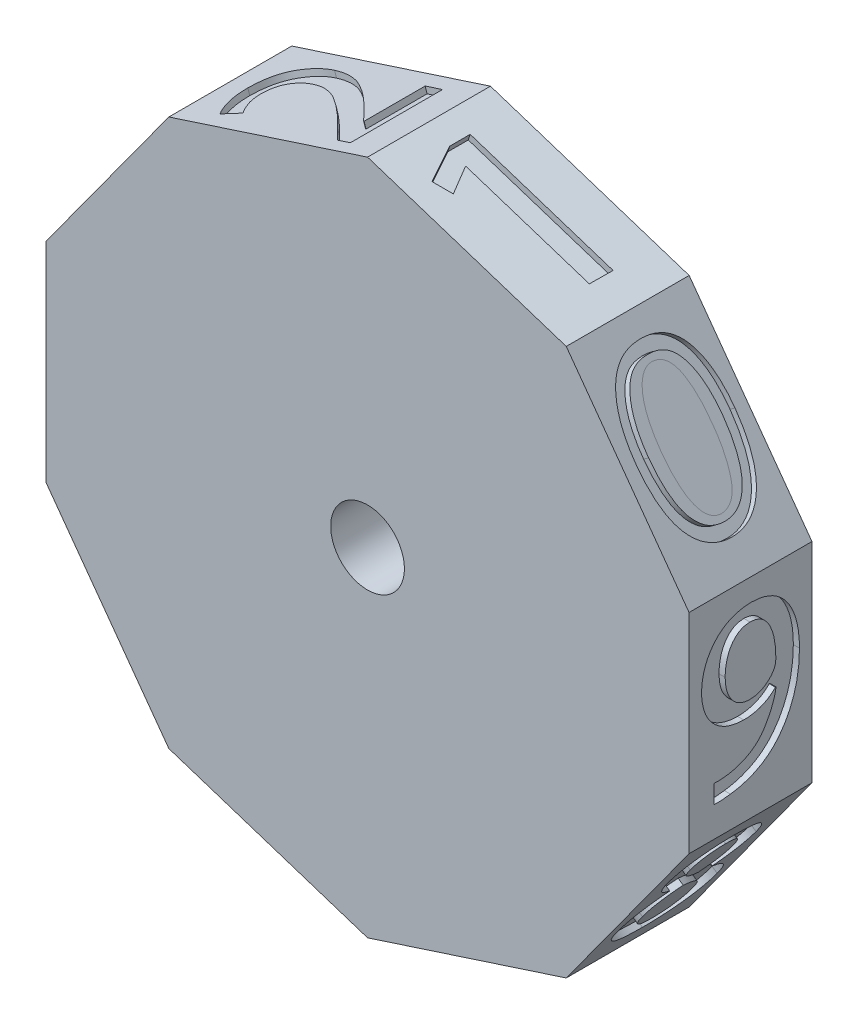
SolidWorks part; units mm, degrees
ref_plane "前基準面" through (0, 0, 0) normal (0, 0, 1) x (1, 0, 0)
ref_plane "上基準面" through (0, 0, 0) normal (0, 1, 0) x (1, 0, 0)
ref_plane "右基準面" through (0, 0, 0) normal (1, 0, 0) x (0, 0, -1)
sketch "草圖1" plane through (0, 0, 0) normal (0, 0, 1) x (1, 0, 0)
  line L0 (-32.3359, 44.5066) -> (-52.3206, 17)
  line L1 (0, -55.0132) -> (32.3359, -44.5066)
  line L2 (32.3359, -44.5066) -> (52.3206, -17)
  line L3 (52.3206, -17) -> (52.3206, 17)
  line L4 (52.3206, 17) -> (32.3359, 44.5066)
  line L5 (32.3359, 44.5066) -> (0, 55.0132)
  line L6 (0, 55.0132) -> (-32.3359, 44.5066)
  line L7 (-52.3206, 17) -> (-52.3206, -17)
  line L8 (-52.3206, -17) -> (-32.3359, -44.5066)
  line L9 (-32.3359, -44.5066) -> (0, -55.0132)
  circle A0 centre (0, 0) radius 52.3206 construction
  circle A1 centre (0, 0) radius 6
  dimension "D2" = 12
  dimension "D1" = 34
extrude "填料-伸長1" add sketch "草圖1" along normal mid plane 20
sketch "草圖2" plane through (42.3283, 30.7533, 0) normal (0.809, 0.5878, 0) x (0, 0, -1)
  text T0 "0  " font "@Adobe 黑体 Std R" height 25
wrap "包覆1" sketch "草圖2" wrap type scribe source sketch "草圖2"
sketch "草圖4" plane through (16.168, 49.7599, 0) normal (0.309, 0.9511, 0) x (0.9511, -0.309, 0)
  line L0 (11.5497, 10) -> (11.5497, -10) construction
  line L1 (17, 10) -> (-17, 10) construction
  line L2 (17, -10) -> (-17, -10) construction
  text T0 "1" font "@Adobe 黑体 Std R" height 25
wrap "包覆2" sketch "草圖4" wrap type deboss source sketch "草圖4" thickness 1 parameters "D1"=1
sketch "草圖6" plane through (-16.168, 49.7599, 0) normal (-0.309, 0.9511, 0) x (0.9511, 0.309, 0)
  line L0 (11.6881, 10) -> (11.6881, -10) construction
  line L1 (17, 10) -> (-17, 10) construction
  line L2 (17, -10) -> (-17, -10) construction
  text T0 "2  " font "@Adobe 黑体 Std R" height 25
wrap "包覆3" sketch "草圖6" wrap type deboss source sketch "草圖6" thickness 1 parameters "D1"=1
sketch "草圖8" plane through (-42.3283, 30.7533, 0) normal (-0.809, 0.5878, 0) x (0, 0, 1)
  line L0 (-10, 10.6951) -> (10, 10.6951) construction
  line L1 (-10, 17) -> (-10, -17) construction
  line L2 (10, 17) -> (10, -17) construction
  text T0 "3  " font "@Adobe 黑体 Std R" height 25
wrap "包覆4" sketch "草圖8" wrap type deboss source sketch "草圖8" thickness 1 parameters "D1"=1
sketch "草圖9" plane through (-52.3206, 0, 0) normal (-1, 0, 0) x (0, 0, 1)
  line L0 (10, 11.2281) -> (-10, 11.2281) construction
  line L1 (10, 17) -> (10, -17) construction
  line L2 (-10, 17) -> (-10, -17) construction
  text T0 "4  " font "@Adobe 黑体 Std R" height 25
wrap "包覆5" sketch "草圖9" wrap type deboss source sketch "草圖9" thickness 1 parameters "D1"=1
sketch "草圖10" plane through (-42.3283, -30.7533, 0) normal (-0.809, -0.5878, 0) x (0, 0, 1)
  line L0 (10, 10.2731) -> (-10, 10.2731) construction
  line L1 (10, 17) -> (10, -17) construction
  line L2 (-10, 17) -> (-10, -17) construction
  text T0 "5  " font "@Adobe 黑体 Std R" height 25
wrap "包覆6" sketch "草圖10" wrap type deboss source sketch "草圖10" thickness 1 parameters "D1"=1
sketch "草圖11" plane through (-16.168, -49.7599, 0) normal (-0.309, -0.9511, 0) x (0.9511, -0.309, 0)
  line L0 (-12.4961, 10) -> (-12.4961, -10) construction
  line L1 (-17, 10) -> (17, 10) construction
  line L2 (-17, -10) -> (17, -10) construction
  text T0 "6" font "@Adobe 黑体 Std R" height 25
wrap "包覆7" sketch "草圖11" wrap type deboss source sketch "草圖11" thickness 1 parameters "D1"=1
sketch "草圖12" plane through (16.168, -49.7599, 0) normal (0.309, -0.9511, 0) x (0.9511, 0.309, 0)
  line L0 (-12.6771, 10) -> (-12.6771, -10) construction
  line L1 (-17, 10) -> (17, 10) construction
  line L2 (-17, -10) -> (17, -10) construction
  text T0 "7" font "@Adobe 黑体 Std R" height 25
wrap "包覆8" sketch "草圖12" wrap type scribe source sketch "草圖12"
sketch "草圖13" plane through (42.3283, -30.7533, 0) normal (0.809, -0.5878, 0) x (0, 0, -1)
  line L0 (-10, -12.4282) -> (10, -12.4282) construction
  line L1 (-10, -17) -> (-10, 17) construction
  line L2 (10, -17) -> (10, 17) construction
  text T0 "8" font "@Adobe 黑体 Std R" height 25
wrap "包覆9" sketch "草圖13" wrap type deboss source sketch "草圖13" thickness 1 parameters "D1"=1
sketch "草圖14" plane through (52.3206, 0, 0) normal (1, 0, 0) x (0, 0, -1)
  line L0 (-10, -11.6825) -> (10, -11.6825) construction
  line L1 (-10, -17) -> (-10, 17) construction
  line L2 (10, -17) -> (10, 17) construction
  text T0 "9" font "@Adobe 黑体 Std R" height 25
wrap "包覆10" sketch "草圖14" wrap type deboss source sketch "草圖14" thickness 1 parameters "D1"=1
sketch "草圖15" plane through (0, 0, 0) normal (0, 0, 1) x (1, 0, 0)
  line L0 (0, 0) -> (16.168, -49.7599) construction
  line L1 (0, -55.0132) -> (32.3359, -44.5066) construction
  line L2 (8.084, -24.8799) -> (26.1044, -19.0247) construction
  line L3 (0, 0) -> (42.3283, 30.7533) construction
  line L4 (52.3206, 17) -> (32.3359, 44.5066) construction
  line L5 (21.1641, 15.3766) -> (27.1351, 7.1583) construction
ref_plane "7 plane" through (8.084, -24.8799, 0) normal (0.9511, 0.309, 0) x (0, 0, -1)
ref_plane "zero plane" through (21.1641, 15.3766, 0) normal (0.5878, -0.809, 0) x (-0.809, -0.5878, 0)
ref_plane "平面1" [suppressed] through (50.4184, 36.6311, 0) normal (0.809, 0.5878, 0) x (0, 0, -1)
sketch "草圖19" plane through (50.4184, 36.6311, 0) normal (0.809, 0.5878, 0) x (0, 0, -1)
  line L0 (0, 0) -> (0, -5.0283)
  line L1 (-0.2328, 13.4505) -> (0.2328, 13.4505)
  line L2 (-0.1365, 11.4529) -> (0.1365, 11.4529)
  spline S0 degree 3 poles (2006.963, 45.353) (-12.3021, 52.2228) (8.8391, 25.7382) (7.9946, -0.66) (7.942, -1.4686) (7.8657, -2.2753) (7.765, -3.0794) (7.6334, -3.8791) (7.4695, -4.6728) (7.2725, -5.459) (7.0336, -6.2337) (6.748, -6.9925) (6.4111, -7.7303) (6.0159, -8.4387) (5.5627, -9.1116) (5.0474, -9.7387) (4.4656, -10.3052) (3.8213, -10.7996) (3.1199, -11.2099) (2.3698, -11.5221) (1.5881, -11.7415) (-12.5393, -13.9191) (-29.6122, 27.3276) (107.4379, -2008.7837) knots -4.513472 -4.513472 -4.513472 -4.513472 0.04762 0.095231 0.142847 0.190471 0.238089 0.285705 0.333326 0.380947 0.428566 0.476189 0.52381 0.571431 0.619053 0.666674 0.71429 0.761913 0.809526 0.857143 0.904769 0.952377 3.37018 3.37018 3.37018 3.37018 only from (8.0323, 0.96) to (-0.0253, -11.892) construction
  spline S1 degree 3 poles (8.0323, 0.96) (8.0284, 0.6899) (8.0205, 0.1499) (7.9946, -0.66) (7.942, -1.4686) (7.8657, -2.2753) (7.765, -3.0794) (7.6334, -3.8791) (7.4695, -4.6728) (7.2725, -5.459) (7.0336, -6.2337) (6.748, -6.9925) (6.4111, -7.7303) (6.0159, -8.4387) (5.5627, -9.1116) (5.0474, -9.7387) (4.4656, -10.3052) (3.8213, -10.7996) (3.1199, -11.2099) (2.3698, -11.5221) (1.5881, -11.7415) (0.785, -11.8653) (0.2448, -11.8831) (-0.0253, -11.892) knots 0 0 0 0 0.04762 0.095231 0.142847 0.190471 0.238089 0.285705 0.333326 0.380947 0.428566 0.476189 0.52381 0.571431 0.619053 0.666674 0.71429 0.761913 0.809526 0.857143 0.904769 0.952377 1 1 1 1
  spline S2 degree 3 poles (149.7899, 2007.6248) (-30.1284, -26.1986) (-12.1532, 15.7361) (1.8706, 13.2676) (2.6627, 13.0338) (3.4184, 12.6984) (4.1203, 12.2612) (4.7535, 11.73) (5.318, 11.1271) (5.8107, 10.4644) (6.2332, 9.7555) (6.6009, 9.0171) (6.9163, 8.255) (7.1805, 7.4739) (7.4066, 6.6811) (7.5942, 5.8782) (7.7384, 5.0664) (7.8501, 4.2497) (7.9352, 3.4299) (7.9969, 2.6079) (8.8057, -21.0671) (-15.5818, -44.7934) (2007.1541, -41.8423) knots -2.434396 -2.434396 -2.434396 -2.434396 0.050007 0.099991 0.150006 0.199995 0.25 0.29999 0.350001 0.399992 0.450001 0.500001 0.550003 0.600001 0.650007 0.700003 0.750005 0.800004 0.850006 0.900007 0.949997 5.1606 5.1606 5.1606 5.1606 only from (0.2328, 13.4505) to (8.0323, 0.96) construction
  spline S3 degree 3 poles (0.2328, 13.4505) (0.5075, 13.4373) (1.0566, 13.4108) (1.8706, 13.2676) (2.6627, 13.0338) (3.4184, 12.6984) (4.1203, 12.2612) (4.7535, 11.73) (5.318, 11.1271) (5.8107, 10.4644) (6.2332, 9.7555) (6.6009, 9.0171) (6.9163, 8.255) (7.1805, 7.4739) (7.4066, 6.6811) (7.5942, 5.8782) (7.7384, 5.0664) (7.8501, 4.2497) (7.9352, 3.4299) (7.9969, 2.6079) (8.025, 1.7841) (8.0299, 1.2347) (8.0323, 0.96) knots 0 0 0 0 0.050007 0.099991 0.150006 0.199995 0.25 0.29999 0.350001 0.399992 0.450001 0.500001 0.550003 0.600001 0.650007 0.700003 0.750005 0.800004 0.850006 0.900007 0.949997 1 1 1 1
  spline S4 degree 3 poles (-8.0323, 0.96) (-8.0284, 0.6899) (-8.0205, 0.1499) (-7.9946, -0.66) (-7.942, -1.4686) (-7.8657, -2.2753) (-7.765, -3.0794) (-7.6334, -3.8791) (-7.4695, -4.6728) (-7.2725, -5.459) (-7.0336, -6.2337) (-6.748, -6.9925) (-6.4111, -7.7303) (-6.0159, -8.4387) (-5.5627, -9.1116) (-5.0474, -9.7387) (-4.4656, -10.3052) (-3.8213, -10.7996) (-3.1199, -11.2099) (-2.3698, -11.5221) (-1.5881, -11.7415) (-0.785, -11.8653) (-0.2448, -11.8831) (0.0253, -11.892) knots 0 0 0 0 0.04762 0.095231 0.142847 0.190471 0.238089 0.285705 0.333326 0.380947 0.428566 0.476189 0.52381 0.571431 0.619053 0.666674 0.71429 0.761913 0.809526 0.857143 0.904769 0.952377 1 1 1 1
  spline S5 degree 3 poles (-0.2328, 13.4505) (-0.5075, 13.4373) (-1.0566, 13.4108) (-1.8706, 13.2676) (-2.6627, 13.0338) (-3.4184, 12.6984) (-4.1203, 12.2612) (-4.7535, 11.73) (-5.318, 11.1271) (-5.8107, 10.4644) (-6.2332, 9.7555) (-6.6009, 9.0171) (-6.9163, 8.255) (-7.1805, 7.4739) (-7.4066, 6.6811) (-7.5942, 5.8782) (-7.7384, 5.0664) (-7.8501, 4.2497) (-7.9352, 3.4299) (-7.9969, 2.6079) (-8.025, 1.7841) (-8.0299, 1.2347) (-8.0323, 0.96) knots 0 0 0 0 0.050007 0.099991 0.150006 0.199995 0.25 0.29999 0.350001 0.399992 0.450001 0.500001 0.550003 0.600001 0.650007 0.700003 0.750005 0.800004 0.850006 0.900007 0.949997 1 1 1 1
  spline S6 degree 1 poles (0.1365, 11.4529) (6.0322, 0.9657) knots 0 0 1 1 construction
  spline S7 degree 1 poles (6.0322, 0.9657) (-0.0911, -9.893) knots 0 0 1 1 construction
  spline S8 degree 3 poles (0.1365, 11.4529) (0.2915, 11.4454) (0.6285, 11.4286) (0.9707, 11.393) (1.3362, 11.3268) (2.0579, 11.1409) (2.9605, 10.704) (3.9901, 9.6702) (4.8041, 8.2345) (5.4007, 6.5528) (5.7833, 4.801) (5.9594, 3.1907) (6.023, 1.97) (6.0293, 1.2951) (6.0322, 0.9657) knots 0 0 0 0 0.031205 0.062411 0.093616 0.124822 0.249643 0.374465 0.499286 0.624108 0.748929 0.873751 0.936162 0.998573 0.998573 0.998573 0.998573
  spline S9 degree 3 poles (6.0322, 0.9657) (6.0272, 0.6221) (6.017, -0.0793) (5.9549, -1.3682) (5.7093, -3.6597) (5.0859, -6.0873) (3.9379, -8.0391) (3.0206, -8.9439) (2.1996, -9.437) (1.6263, -9.6568) (1.1443, -9.7797) (0.7712, -9.8431) (0.4154, -9.8758) (0.0686, -9.8878) (-0.0911, -9.893) knots 0.001383 0.001383 0.001383 0.001383 0.063796 0.12621 0.251037 0.500691 0.625518 0.750346 0.812759 0.875173 0.90638 0.937586 0.968793 1 1 1 1
  spline S10 degree 1 poles (-0.1365, 11.4529) (-6.0322, 0.9657) knots 0 0 1 1 construction
  spline S11 degree 1 poles (-6.0322, 0.9657) (0.0911, -9.893) knots 0 0 1 1 construction
  spline S12 degree 3 poles (-0.1365, 11.4529) (-0.2915, 11.4454) (-0.6285, 11.4286) (-0.9707, 11.393) (-1.3362, 11.3268) (-2.0579, 11.1409) (-2.9605, 10.704) (-3.9901, 9.6702) (-4.8041, 8.2345) (-5.4007, 6.5528) (-5.7833, 4.801) (-5.9594, 3.1907) (-6.023, 1.97) (-6.0293, 1.2951) (-6.0322, 0.9657) knots 0 0 0 0 0.031205 0.062411 0.093616 0.124822 0.249643 0.374465 0.499286 0.624108 0.748929 0.873751 0.936162 0.998573 0.998573 0.998573 0.998573
  spline S13 degree 3 poles (-6.0322, 0.9657) (-6.0272, 0.6221) (-6.017, -0.0793) (-5.9549, -1.3682) (-5.7093, -3.6597) (-5.0859, -6.0873) (-3.9379, -8.0391) (-3.0206, -8.9439) (-2.1996, -9.437) (-1.6263, -9.6568) (-1.1443, -9.7797) (-0.7712, -9.8431) (-0.4154, -9.8758) (-0.0686, -9.8878) (0.0911, -9.893) knots 0.001383 0.001383 0.001383 0.001383 0.063796 0.12621 0.251037 0.500691 0.625518 0.750346 0.812759 0.875173 0.90638 0.937586 0.968793 1 1 1 1
  dimension "D1" = 2
  dimension "D2" = 2
extrude "除料-伸長1" cut sketch "草圖19" against normal blind 11
ref_plane "平面2" through (19.2581, -59.2704, 0) normal (0.309, -0.9511, 0) x (-0.9511, -0.309, 0)
sketch "草圖20" plane through (19.2581, -59.2704, 0) normal (0.309, -0.9511, 0) x (-0.9511, -0.309, 0)
  line L0 (-9.5271, 7.3885) -> (12.6382, -2.3225) construction
  line L1 (-9.5271, 7.3885) -> (12.6382, -2.3225)
  line L2 (-11.7867, -7.3885) -> (-11.7867, 7.3885) construction
  line L3 (-11.7867, -7.3885) -> (-11.7867, 7.3885)
  line L4 (12.6382, -2.3225) -> (12.6382, -6.1874) construction
  line L5 (12.6382, -2.3225) -> (12.6382, -6.1874)
  line L6 (12.6382, -6.1874) -> (-8.7499, 3.5236) construction
  line L7 (12.6382, -6.1874) -> (-8.7499, 3.5236)
  line L8 (-11.7867, 7.3885) -> (-9.5271, 7.3885) construction
  line L9 (-11.7867, 7.3885) -> (-9.5271, 7.3885)
  line L10 (-8.8153, 3.5236) -> (-8.8153, -7.3885) construction
  line L11 (-8.8153, 3.5236) -> (-8.8153, -7.3885)
  line L12 (-8.8153, -7.3885) -> (-11.7867, -7.3885) construction
  line L13 (-8.8153, -7.3885) -> (-11.7867, -7.3885)
  line L14 (-8.8153, 3.5236) -> (-8.7499, 3.5236)
extrude "除料-伸長3" cut sketch "草圖20" against normal blind 11
